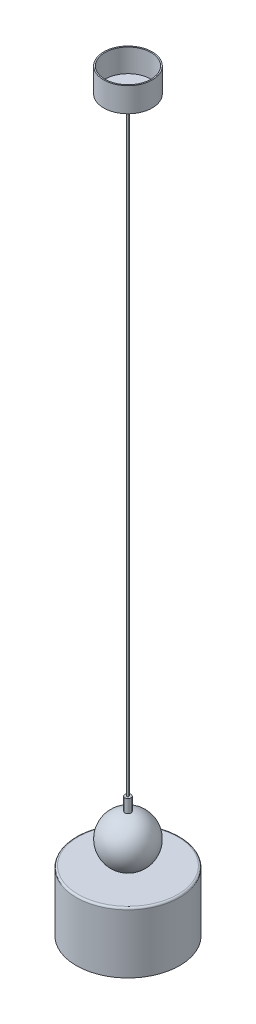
SolidWorks part; units mm, degrees
ref_plane "Alzado" through (0, 0, 0) normal (0, 0, 1) x (1, 0, 0)
ref_plane "Planta" through (0, 0, 0) normal (0, 1, 0) x (1, 0, 0)
ref_plane "Vista lateral" through (0, 0, 0) normal (1, 0, 0) x (0, 0, -1)
sketch "Croquis1" plane through (0, 0, 0) normal (0, 1, 0) x (1, 0, 0)
  circle A0 centre (0, 0) radius 85
extrude "Saliente-Extruir1" add sketch "Croquis1" along normal blind 100
fillet "Redondeo1" radius 3 1 edges at (0, 100, 85)
shell "Vaciado1" thickness 3
sketch "Croquis2" plane through (0, 0, 0) normal (0, 0, 1) x (1, 0, 0)
  line L0 (0, 97.9605) -> (0, 137.9605)
  line L2 (0, 137.9605) -> (-40, 137.9605)
  arc A0 (-40, 137.9605) -> (0, 97.9605) centre (0, 137.9605) ccw
revolve "Revolución1" add sketch "Croquis2" angle 360 about L2
mirror "Simetría4" about plane through (0, 0, 0) normal (1, 0, 0)
sketch "Croquis3" plane through (0, 97, 0) normal (0, -1, 0) x (1, 0, 0)
  circle A0 centre (0, 0) radius 34.8727
extrude "Saliente-Extruir2" add sketch "Croquis3" along normal blind 50 separate body
ref_plane "Plano1" through (0, 170, 0) normal (0, 1, 0) x (1, 0, 0)
sketch "Croquis4" plane through (0, 170, 0) normal (0, 1, 0) x (1, 0, 0)
  circle A0 centre (0, 0) radius 5
extrude "Saliente-Extruir3" add sketch "Croquis4" along normal blind 29 separate body
sketch "Croquis5" plane through (0, 199, 0) normal (0, 1, 0) x (1, 0, 0)
  circle A0 centre (0, 0) radius 1.5
extrude "Saliente-Extruir4" add sketch "Croquis5" along normal blind 1000 separate body
sketch "Croquis6" plane through (0, 1199, 0) normal (0, 1, 0) x (1, 0, 0)
  circle A0 centre (0, 0) radius 40
extrude "Saliente-Extruir5" add sketch "Croquis6" along normal blind 40 separate body
shell "Vaciado2" thickness 2
